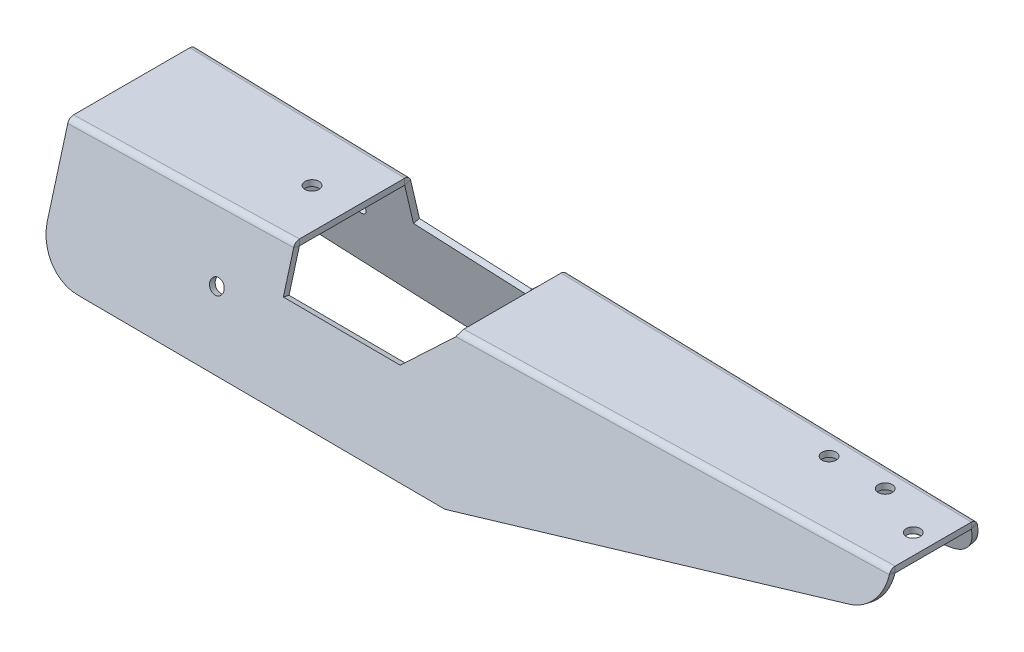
SolidWorks part; units mm, degrees
ref_plane "Front" through (0, 0, 0) normal (0, 0, 1) x (1, 0, 0)
ref_plane "Top" through (0, 0, 0) normal (0, 1, 0) x (1, 0, 0)
ref_plane "Right" through (0, 0, 0) normal (1, 0, 0) x (0, 0, -1)
sketch "Sketch1" plane through (0, 0, 0) normal (0, 1, 0) x (1, 0, 0)
  line L0 (121.6575, 10.216) -> (121.6575, -10.216)
  line L1 (-78.3425, -35) -> (-78.3425, 35)
  line L2 (16.6575, 12.6252) -> (16.6575, -12.6252)
  line L4 (-23.3425, -24) -> (-23.3425, 24)
  line L5 (21.6575, -45) -> (114.2731, -19.9021)
  line L6 (16.6575, -12.6252) -> (5.2827, -24)
  line L7 (-68.3425, 45) -> (21.6575, 45)
  line L8 (-23.3425, 24) -> (5.2827, 24)
  line L10 (-23.3425, -24) -> (5.2827, -24)
  line L11 (16.6575, 12.6252) -> (5.2827, 24)
  line L12 (21.6575, 45) -> (114.2731, 19.9021)
  line L14 (-68.3425, -45) -> (21.6575, -45)
  circle A0 centre (-38.3425, 29) radius 1.75
  circle A1 centre (-33.3425, 0) radius 1.75
  arc A2 (-78.3425, 35) -> (-68.3425, 45) centre (-68.3425, 35) cw
  circle A3 centre (116.6575, 0) radius 1.75
  circle A4 centre (103.6575, 6) radius 1.75
  circle A5 centre (89.6575, 6) radius 1.75
  arc A6 (121.6575, -10.216) -> (114.2731, -19.9021) centre (111.6575, -10.2502) cw
  arc A7 (121.6575, 10.216) -> (114.2731, 19.9021) centre (111.6575, 10.2502) ccw
  arc A10 (-78.3425, -35) -> (-68.3425, -45) centre (-68.3425, -35) ccw
  circle A11 centre (-38.3425, -29) radius 1.75
  point P8 (16.6575, 0)
  point P47 (-23.3425, 0)
sheet metal parameters "Sheet-Metal3" thickness 1.5 parameters "D1"=0.01
base flange "Base-Flange1" sketch "Sketch1" thickness 1.5 reverse thickness direction yes parameters "D1"=0.01
sketch "Sketch11" plane through (0, 1.5, 0) normal (0, 1, 0) x (-1, 0, 0)
  line L7 (-121.6575, 10) -> (78.3425, 15)
  line L8 (78.3425, -15) -> (-121.6575, -10)
sketched bend "Sketched Bend1" parameters "D1"=0
bend "SketchBend1" bend radius 0.01 bend angle 76 parameters "D5"=1
bend "SketchBend2" bend radius 0 bend angle 76 parameters "D5"=2
flat pattern "Flat-Pattern3"
sketch "Bend-Lines3" plane through (0, 0, 0) normal (0, 1, 0) x (-1, 0, 0)
bend of the flat pattern "Flatten-<SketchBend1>1"
bend of the flat pattern "Flatten-<SketchBend2>1"
